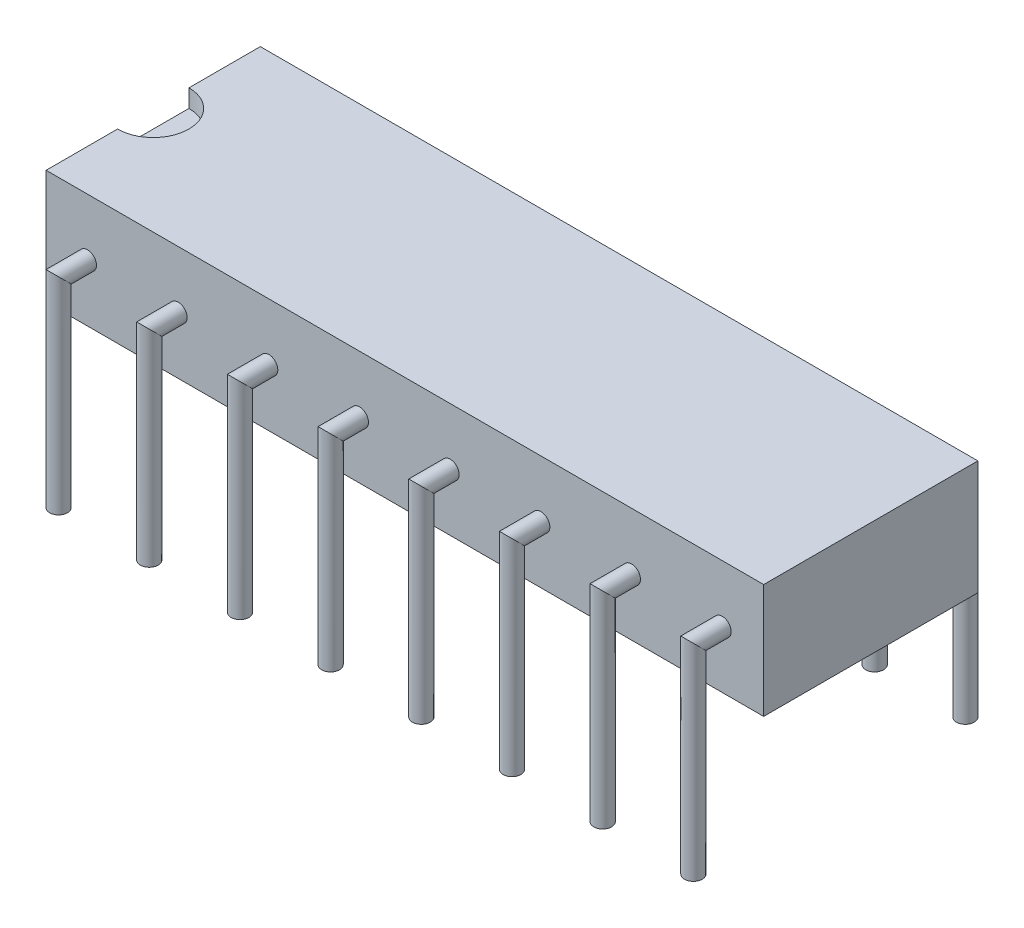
SolidWorks part; units mm, degrees
ref_plane "Plan de face" through (0, 0, 0) normal (0, 0, 1) x (1, 0, 0)
ref_plane "Plan de dessus" through (0, 0, 0) normal (0, 1, 0) x (1, 0, 0)
ref_plane "Plan de droite" through (0, 0, 0) normal (1, 0, 0) x (0, 0, -1)
sketch "Esquisse1" plane through (0, 0, 0) normal (1, 0, 0) x (0, 0, -1)
  line L0 (-34.0084, 0) -> (28.7946, 0) construction
  line L1 (0, -15.76) -> (0, 25.9507) construction
  line L2 (-13.1897, 3.2) -> (13.1184, 3.2) construction
  line L3 (3, 10.112) -> (3, -6.1718) construction
  line L4 (-3, 10.112) -> (-3, -4.99) construction
  line L6 (-3, 3.2) -> (3, 3.2)
  line L7 (-3, 3.2) -> (-3, 0)
  line L8 (-3, 0) -> (3, 0)
  line L9 (3, 3.2) -> (3, 0)
  dimension "D1" = 3
  dimension "D2" = 6
  dimension "D3" = 3.2
extrude "Extrusion1" add sketch "Esquisse1" along normal blind 20.1
sketch "Esquisse2" plane through (0, 3.2, 0) normal (0, 1, 0) x (-1, 0, 0)
  line L0 (0, -1) -> (0, 1)
  arc A0 (0, 1) -> (0, -1) centre (0, 0) ccw
extrude "Enlèv. mat.-Extru.1" cut sketch "Esquisse2" against normal blind 0.5
sketch "Esquisse3" plane through (0, 0, 3) normal (0, 0, 1) x (1, 0, 0)
  line L0 (-0.9705, 0) -> (10.7632, 0) construction
  line L1 (0, 4.319) -> (0, -1.0907) construction
  line L2 (-0.7349, 1.6) -> (2.3847, 1.6) construction
  line L3 (1.16, 2.698) -> (1.16, -1.0907) construction
  circle A0 centre (1.16, 1.6) radius 0.25
  dimension "D1" = 1.6
  dimension "D2" = 1.16
ref_plane "Plan1" through (1.16, 0, 0) normal (1, 0, 0) x (0, 0, -1)
sketch "Esquisse5" plane through (1.16, 0, 0) normal (1, 0, 0) x (0, 0, -1)
  line L0 (-4.2866, 0) -> (4.976, 0) construction
  line L1 (-3, -1.7147) -> (-3, 5.2592) construction
  line L2 (-4.2866, -4) -> (4.976, -4) construction
  line L3 (-3.81, -4.4343) -> (-3.81, 4.8284) construction
  line L4 (-3, 1.85) -> (-3, 1.35) construction
  line L5 (-3, 1.6) -> (-3.81, 1.6)
  line L6 (-3.81, 1.6) -> (-3.81, -4)
  dimension "D1" = 4
  dimension "D2" = 0.81
sweep "Balayage1" add profiles "Esquisse3" path "Esquisse5"
ref_plane "Plan2" through (0, 0, 0) normal (0, 0, 1) x (1, 0, 0)
mirror "Symétrie1" about plane through (0, 0, 0) normal (0, 0, 1) of "Balayage1"
pattern_linear "Répétition linéaire1" count 8 spacing 2.54 along (1, 0, 0) of "Balayage1", "Symétrie1"
